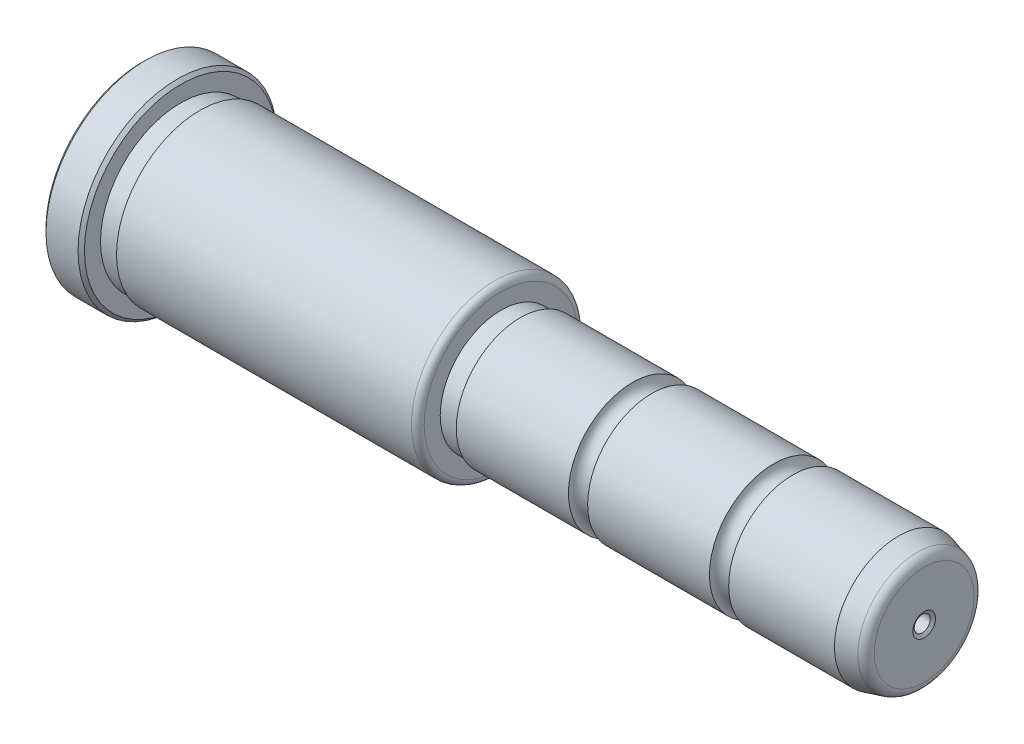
SolidWorks part; units mm, degrees
ref_plane "Plano frontal" through (0, 0, 0) normal (0, 0, 1) x (1, 0, 0)
ref_plane "Plano superior" through (0, 0, 0) normal (0, 1, 0) x (1, 0, 0)
ref_plane "Plano direito" through (0, 0, 0) normal (1, 0, 0) x (0, 0, -1)
sketch "Esboço1" plane through (0, 0, 0) normal (0, 0, 1) x (1, 0, 0)
  line L0 (0, 0) -> (132, 0) construction
  line L5 (0, 0) -> (0, 15.5)
  line L6 (0, 15.5) -> (6, 15.5)
  line L7 (6, 15.5) -> (6, 12.5)
  line L8 (6, 12.5) -> (9, 12.5)
  line L9 (9, 12.5) -> (9, 13)
  line L10 (9, 13) -> (56, 13)
  line L11 (56, 13) -> (56, 9.5)
  line L12 (56, 9.5) -> (59, 9.5)
  line L13 (59, 9.5) -> (59, 10)
  line L15 (118, 10) -> (122, 8.9282)
  line L16 (122, 8.9282) -> (122, 0)
  line L18 (59, 10) -> (76.5, 10)
  line L19 (0, 0) -> (122, 0)
  line L20 (101.5, 10) -> (118, 10)
  line L21 (79.5, 10) -> (98.5, 10)
  arc A0 (98.5, 10) -> (101.5, 10) centre (100, 10) ccw
  arc A1 (76.5, 10) -> (79.5, 10) centre (78, 10) ccw
  dimension "D14" = 1.5
  dimension "D17" = 22
  dimension "D1" = 31
  dimension "D2" = 26
  dimension "D3" = 3
  dimension "D4" = 0.5
  dimension "D5" = 6
  dimension "D6" = 10
  dimension "D7" = 56
  dimension "D8" = 10
  dimension "D9" = 66
  dimension "D10" = 122
  dimension "D11" = 4
  dimension "D12" = 15
  dimension "D13" = 0.5
  dimension "D15" = 22
  dimension "D16" = 2
revolve "Revolução1" add sketch "Esboço1" angle 360 about L0
hole_wizard "Furo de diâmetro Ø2.5 (2.5)1" positions "Esboço2" profile "Esboço3" hole size "Ø2.5" standard "Ansi Metric"
sketch "Esboço2" plane through (122, 0, 0) normal (1, 0, 0) x (0, 0, -1)
  point P0 (0, 0)
  point P3 (0, 0)
  point P13 (0, 0)
sketch "Esboço3" plane through (122, 0, 0) normal (0, 1, 0) x (0, 0, -1)
  line L0 (0, 0) -> (0, 7.7511)
  line L1 (0, 7.7511) -> (1.25, 7)
  line L2 (1.25, 7) -> (1.25, 0.025)
  line L3 (1.25, 0.025) -> (1.275, 0)
  line L5 (1.275, 0) -> (0, 0)
  line L6 (-1.25, 0.025) -> (-1.275, 0) construction
  line L10 (0, 7.7511) -> (-1.25, 7) construction
  line L11 (0, -6.35) -> (0, 107.95) construction
  dimension "Hole Dia." = 2.5
  dimension "Hole Depth" = 7
  dimension "Near C'Sink Dia." = 2.55
  dimension "Near C'Sink Angle" = 90
  dimension "Drill Angle" = 118
ref_plane "Plano1" through (61, 0, 0) normal (-1, 0, 0) x (0, 0, 1)
mirror "Espelhar1" about plane through (61, 0, 0) normal (-1, 0, 0) of "Furo de diâmetro Ø2.5 (2.5)1"
chamfer "Chanfro1" distance 0.5 angle 30 2 edges at (122, 0, -1.275) (0, 0, 1.275)
chamfer "Chanfro2" distance 0.5 angle 45 2 edges at (0, 0, 15.5) (6, 0, 15.5)
fillet "Filete1" radius 1.5 1 edges at (122, 0, 8.9282)
fillet "Filete2" radius 1 1 edges at (56, 0, 13)
sketch "Esboço4"
  dimension "D1" = 29.9
  dimension "D2" = 24.5
  dimension "D3" = 20.5
wrap "Envolver1" sketch "Esboço4" wrap type deboss source sketch "Esboço4" thickness 0.1 parameters "D1"=0.1
